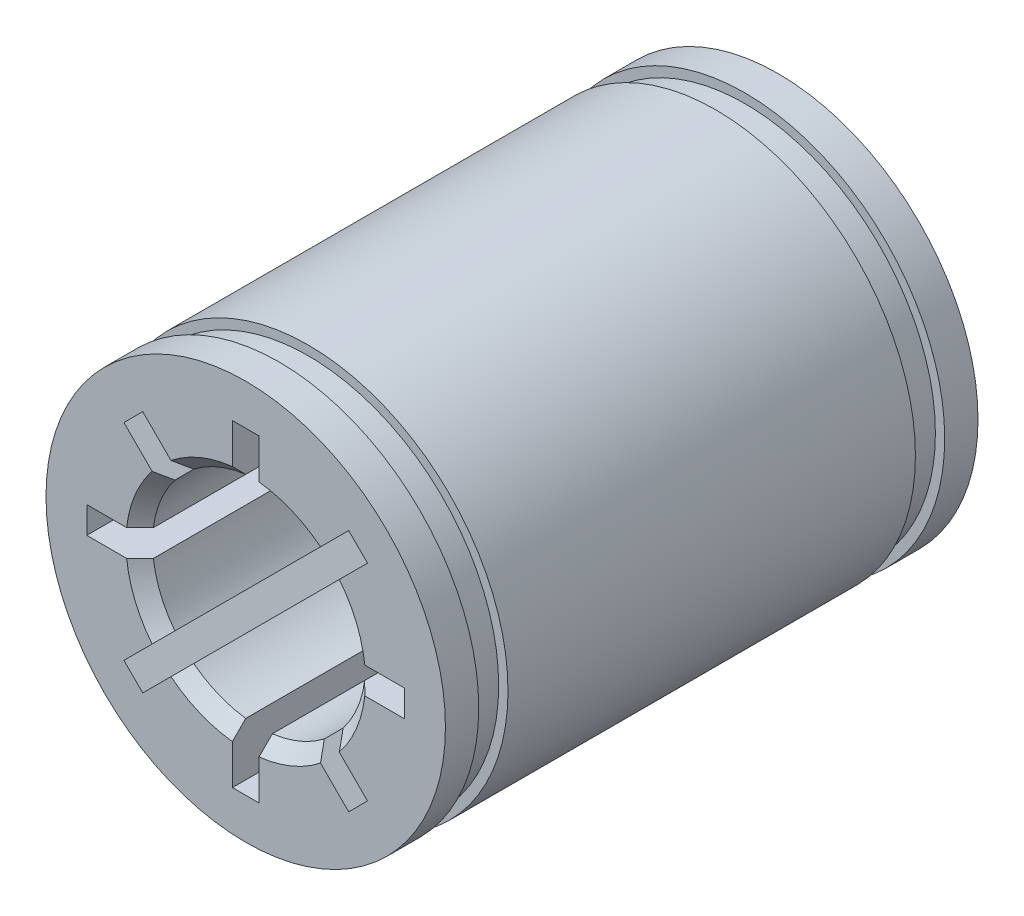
SolidWorks part; units mm, degrees
ref_plane "Plan de face" through (0, 0, 0) normal (0, 0, 1) x (1, 0, 0)
ref_plane "Plan de dessus" through (0, 0, 0) normal (0, 1, 0) x (1, 0, 0)
ref_plane "Plan de droite" through (0, 0, 0) normal (1, 0, 0) x (0, 0, -1)
sketch "Esquisse1" plane through (0, 0, 0) normal (0, 0, 1) x (1, 0, 0)
  line L0 (3.8669, 4.574) -> (2.4527, 3.1598)
  line L1 (-0.5, 5.9686) -> (0.5, 5.9686)
  line L2 (-0.5, 5.9686) -> (-0.5, 3.9686)
  line L3 (3.8669, 4.574) -> (4.574, 3.8669)
  line L4 (0.5, 5.9686) -> (0.5, 3.9686)
  line L5 (4.574, 3.8669) -> (3.1598, 2.4527)
  line L6 (5.9686, 0.5) -> (3.9686, 0.5)
  line L7 (5.9686, 0.5) -> (5.9686, -0.5)
  line L8 (5.9686, -0.5) -> (3.9686, -0.5)
  line L9 (4.574, -3.8669) -> (3.1598, -2.4527)
  line L10 (4.574, -3.8669) -> (3.8669, -4.574)
  line L11 (3.8669, -4.574) -> (2.4527, -3.1598)
  line L12 (0.5, -5.9686) -> (0.5, -3.9686)
  line L13 (0.5, -5.9686) -> (-0.5, -5.9686)
  line L14 (-0.5, -5.9686) -> (-0.5, -3.9686)
  line L15 (-3.8669, -4.574) -> (-2.4527, -3.1598)
  line L16 (-3.8669, -4.574) -> (-4.574, -3.8669)
  line L17 (-4.574, -3.8669) -> (-3.1598, -2.4527)
  line L18 (-5.9686, -0.5) -> (-3.9686, -0.5)
  line L19 (-5.9686, -0.5) -> (-5.9686, 0.5)
  line L20 (-5.9686, 0.5) -> (-3.9686, 0.5)
  line L21 (-4.574, 3.8669) -> (-3.1598, 2.4527)
  line L22 (-4.574, 3.8669) -> (-3.8669, 4.574)
  line L23 (-3.8669, 4.574) -> (-2.4527, 3.1598)
  circle A0 centre (0, 0) radius 7.5
  arc A1 (-3.1598, 2.4527) -> (-3.9686, 0.5) centre (0, 0) ccw
  arc A2 (2.4527, 3.1598) -> (0.5, 3.9686) centre (0, 0) ccw
  arc A3 (-0.5, 3.9686) -> (-2.4527, 3.1598) centre (0, 0) ccw
  arc A4 (3.9686, 0.5) -> (3.1598, 2.4527) centre (0, 0) ccw
  arc A5 (3.1598, -2.4527) -> (3.9686, -0.5) centre (0, 0) ccw
  arc A6 (0.5, -3.9686) -> (2.4527, -3.1598) centre (0, 0) ccw
  arc A7 (-2.4527, -3.1598) -> (-0.5, -3.9686) centre (0, 0) ccw
  arc A8 (-3.9686, -0.5) -> (-3.1598, -2.4527) centre (0, 0) ccw
  point P38 (0, 0)
extrude "Boss.-Extru.1" add sketch "Esquisse1" along normal mid plane 20
ref_axis "Axe1" through (0, 0, 10) along (0, 0, -1)
sketch "Esquisse2" plane through (0, 0, 0) normal (1, 0, 0) x (0, 0, -1)
  line L0 (10, 7.5) -> (-10, 7.5) construction
  line L1 (-8.75, 7.5) -> (-7.65, 7.5)
  line L2 (-8.75, 7.5) -> (-8.75, 7.15)
  line L3 (-8.75, 7.15) -> (-7.65, 7.15)
  line L4 (-7.65, 7.5) -> (-7.65, 7.15)
  line L5 (7.65, 7.5) -> (8.75, 7.5)
  line L6 (7.65, 7.5) -> (7.65, 7.15)
  line L7 (7.65, 7.15) -> (8.75, 7.15)
  line L8 (8.75, 7.5) -> (8.75, 7.15)
revolve "Enlèvement de matière-Révolution1" cut sketch "Esquisse2" angle 360 about axis through (0, 0, 10) along (0, 0, -1)
chamfer "Chanfrein3" distance 0.5 angle 45 16 edges at (-3.6955, -1.5307, 10) (-1.5307, -3.6955, 10) (1.5307, -3.6955, 10) (3.6955, -1.5307, 10) (3.6955, 1.5307, 10) (1.5307, 3.6955, 10) (-1.5307, 3.6955, 10) (-3.6955, 1.5307, 10) (3.6955, 1.5307, -10) (3.6955, -1.5307, -10) (1.5307, -3.6955, -10) (-1.5307, -3.6955, -10) (-3.6955, -1.5307, -10) (-3.6955, 1.5307, -10) (-1.5307, 3.6955, -10) (1.5307, 3.6955, -10)
equation "\"D4@Esquisse1\"=\"D3@Esquisse1\"/2"
equation "\"D2@Esquisse2\"=\"D1@Esquisse2\"/2"
